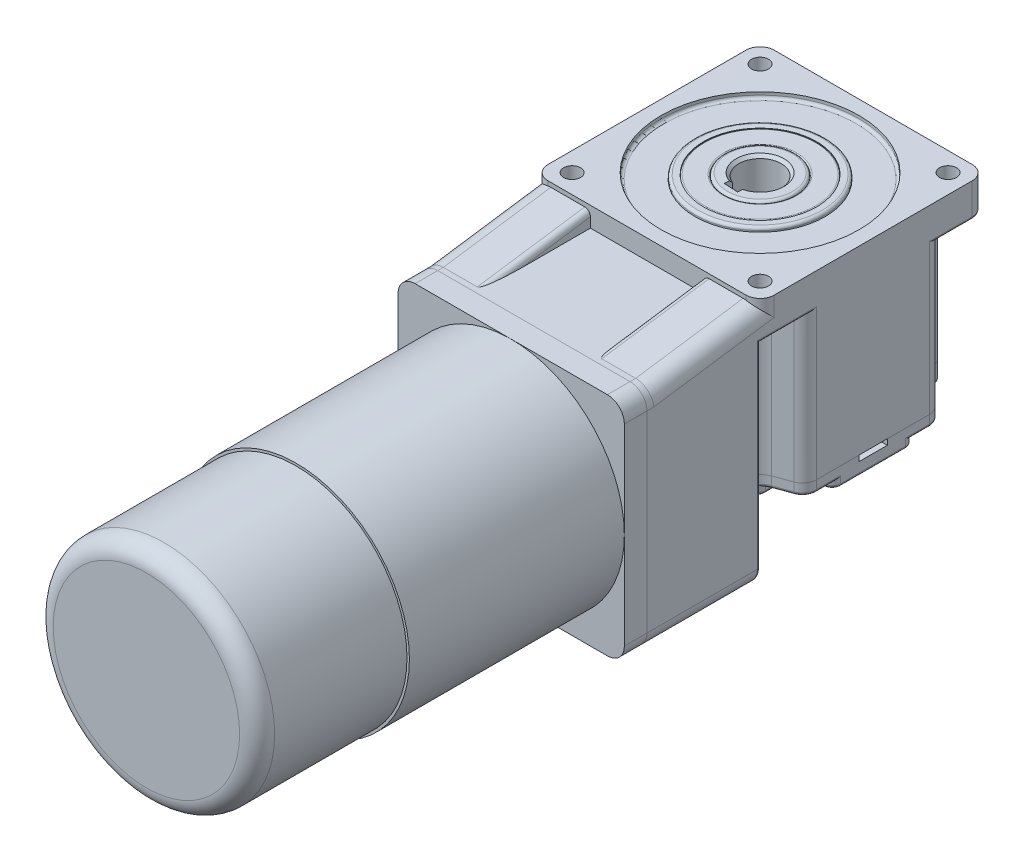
SolidWorks part; units mm, degrees
ref_plane "前视基准面" through (0, 0, 0) normal (0, 0, 1) x (1, 0, 0)
ref_plane "上视基准面" through (0, 0, 0) normal (0, 1, 0) x (1, 0, 0)
ref_plane "右视基准面" through (0, 0, 0) normal (1, 0, 0) x (0, 0, -1)
imported_body "80改进空心箱体-1-surface1"
imported_body "空心输出轴-1-surface1"
imported_body "80改进空心出轴盖-1-surface1"
imported_body "大油封-1-surface1"
imported_body "大油封-2-surface1"
sketch "草图1" plane through (0, 0, 60) normal (0, 0, 1) x (1, 0, 0)
  line L1 (-46.9665, -43.8467) -> (21.0335, -43.8467)
  line L2 (-52.9665, -37.8467) -> (-52.9665, 30.1533)
  line L3 (-46.9665, 36.1533) -> (21.0335, 36.1533)
  line L4 (27.0335, -37.8467) -> (27.0335, 30.1533)
  line L5 (-52.9665, -43.8467) -> (27.0335, 36.1533) construction
  line L6 (-52.9665, 36.1533) -> (27.0335, -43.8467) construction
  arc A0 (-46.9665, -43.8467) -> (-52.9665, -37.8467) centre (-46.9665, -37.8467) cw
  arc A1 (21.0335, -43.8467) -> (27.0335, -37.8467) centre (21.0335, -37.8467) ccw
  arc A2 (21.0335, 36.1533) -> (27.0335, 30.1533) centre (21.0335, 30.1533) cw
  arc A3 (-52.9665, 30.1533) -> (-46.9665, 36.1533) centre (-46.9665, 30.1533) cw
  dimension "D1" = 6
extrude "凸台-拉伸1" add sketch "草图1" along normal blind 8
sketch "草图2" plane through (0, 0, 68) normal (0, 0, 1) x (1, 0, 0)
  circle A0 centre (-12.9665, -3.8467) radius 40
extrude "凸台-拉伸2" add sketch "草图2" along normal blind 76 separate body
sketch "草图3" plane through (0, 0, 144) normal (0, 0, 1) x (1, 0, 0)
  circle A0 centre (-12.9665, -3.8467) radius 39.15
extrude "凸台-拉伸3" add sketch "草图3" along normal blind 53 separate body
fillet "圆角1" radius 6.2 1 edges at (26.1835, -3.8467, 197)
